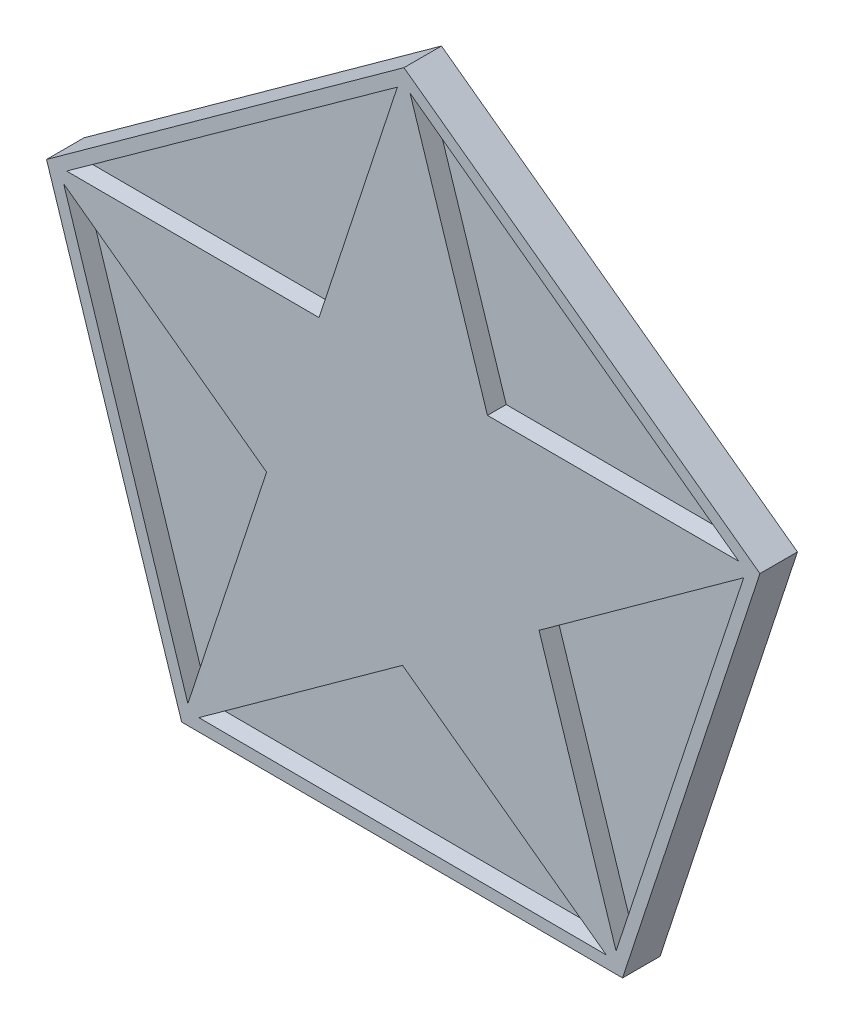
SolidWorks part; units mm, degrees
ref_plane "Alzado" through (0, 0, 0) normal (0, 0, 1) x (1, 0, 0)
ref_plane "Planta" through (0, 0, 0) normal (0, 1, 0) x (1, 0, 0)
ref_plane "Vista lateral" through (0, 0, 0) normal (1, 0, 0) x (0, 0, -1)
sketch "Croquis1" plane through (0, 0, 0) normal (0, 0, 1) x (1, 0, 0)
  line L1 (0.0275, 10) -> (-9.502, 3.1163)
  line L2 (-9.502, 3.1163) -> (-5.9001, -8.074)
  line L3 (-5.9001, -8.074) -> (5.8556, -8.1063)
  line L4 (5.8556, -8.1063) -> (9.519, 3.064)
  line L5 (9.519, 3.064) -> (0.0275, 10)
  circle A0 centre (0, 0) radius 10 construction
  circle A1 centre (0, 0) radius 8.0902 construction
  point P3 (0, 0)
  point P10 (0, 0)
  point P11 (4.7032, -6.485)
  point P12 (0, 0)
  point P13 (0, 0)
  dimension "D1" = 20
  dimension "D2" = 10
extrude "Saliente-Extruir1" add sketch "Croquis1" along normal blind 1
sketch "Croquis2" plane through (0, 0, 1) normal (0, 0, 1) x (1, 0, 0)
  line L1 (0.0426, 9.6002) -> (-9.1172, 3.0071)
  line L2 (-9.1172, 3.0071) -> (-5.6773, -7.7417)
  line L3 (-5.6773, -7.7417) -> (5.6085, -7.7918)
  line L4 (5.6085, -7.7918) -> (9.1435, 2.9262)
  line L5 (9.1435, 2.9262) -> (0.0426, 9.6002)
  circle A0 centre (0, 0) radius 7.7668 construction
  dimension "D1" = 0.4
extrude "Cortar-Extruir1" cut sketch "Croquis2" against normal blind 0.5
sketch "Croquis3" plane through (0, 0, 0.5) normal (0, 0, 1) x (1, 0, 0)
  line L0 (-5.9001, -8.074) -> (-0.0105, -3.8196)
  line L1 (5.8556, -8.1063) -> (-0.0105, -3.8196)
  line L10 (0.0275, 10) -> (-2.2366, 3.0963)
  line L12 (5.8556, -8.1063) -> (3.6295, -1.1903)
  line L13 (-9.502, 3.1163) -> (-2.2366, 3.0963)
  line L14 (-3.6359, -1.1703) -> (-5.9001, -8.074)
  line L15 (-3.6359, -1.1703) -> (-9.502, 3.1163)
  line L16 (3.6295, -1.1903) -> (9.519, 3.064)
  line L17 (2.2536, 3.084) -> (0.0275, 10)
  line L18 (2.2536, 3.084) -> (9.519, 3.064)
extrude "Saliente-Extruir2" add sketch "Croquis3" along normal blind 0.5
